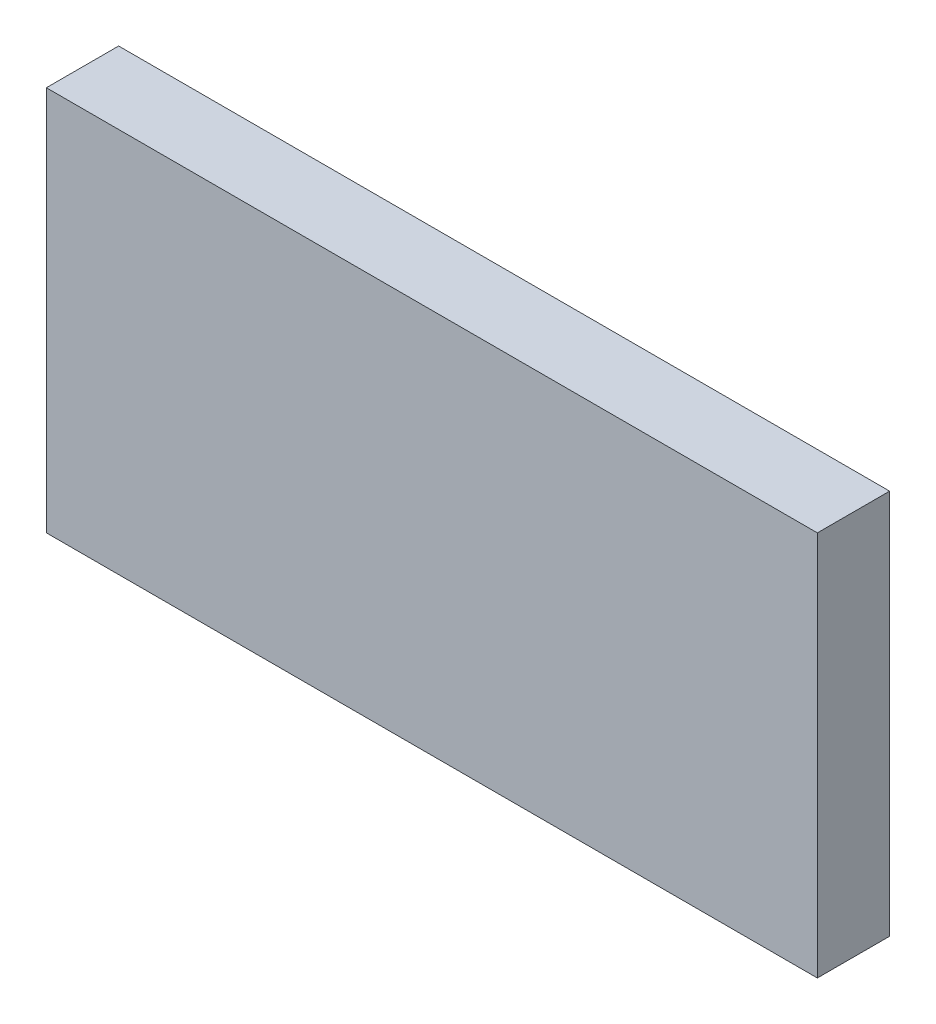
SolidWorks part; units mm, degrees
ref_plane "Front Plane" through (0, 0, 0) normal (0, 0, 1) x (1, 0, 0)
ref_plane "Top Plane" through (0, 0, 0) normal (0, 1, 0) x (1, 0, 0)
ref_plane "Right Plane" through (0, 0, 0) normal (1, 0, 0) x (0, 0, -1)
sketch "Sketch1" plane through (0, 0, 0) normal (0, 1, 0) x (1, 0, 0)
  line L1 (0, 0) -> (203.2, 0)
  line L2 (0, 0) -> (0, 19.05)
  line L3 (0, 19.05) -> (203.2, 19.05)
  line L4 (203.2, 0) -> (203.2, 19.05)
  dimension "D1" = 19.05
  dimension "D2" = 203.2
extrude "Extrude1" add sketch "Sketch1" against normal blind 101.6
